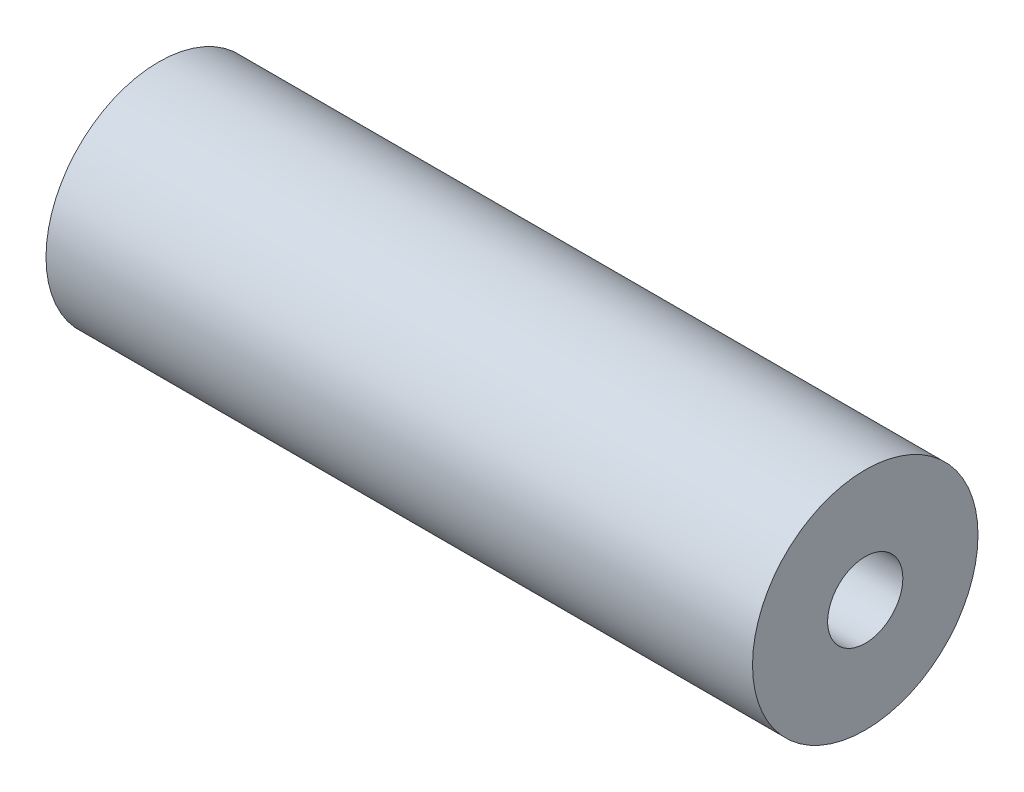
SolidWorks part; units mm, degrees
ref_plane "Front Plane" through (0, 0, 0) normal (0, 0, 1) x (1, 0, 0)
ref_plane "Top Plane" through (0, 0, 0) normal (0, 1, 0) x (1, 0, 0)
ref_plane "Right Plane" through (0, 0, 0) normal (1, 0, 0) x (0, 0, -1)
sketch "Sketch1" plane through (0, 0, 0) normal (1, 0, 0) x (0, 0, -1)
  circle A0 centre (0, 0) radius 7.5
  circle A1 centre (0, 0) radius 2.5
  dimension "D1" = 5
  dimension "D2" = 15
extrude "Boss-Extrude1" add sketch "Sketch1" along normal blind 47
